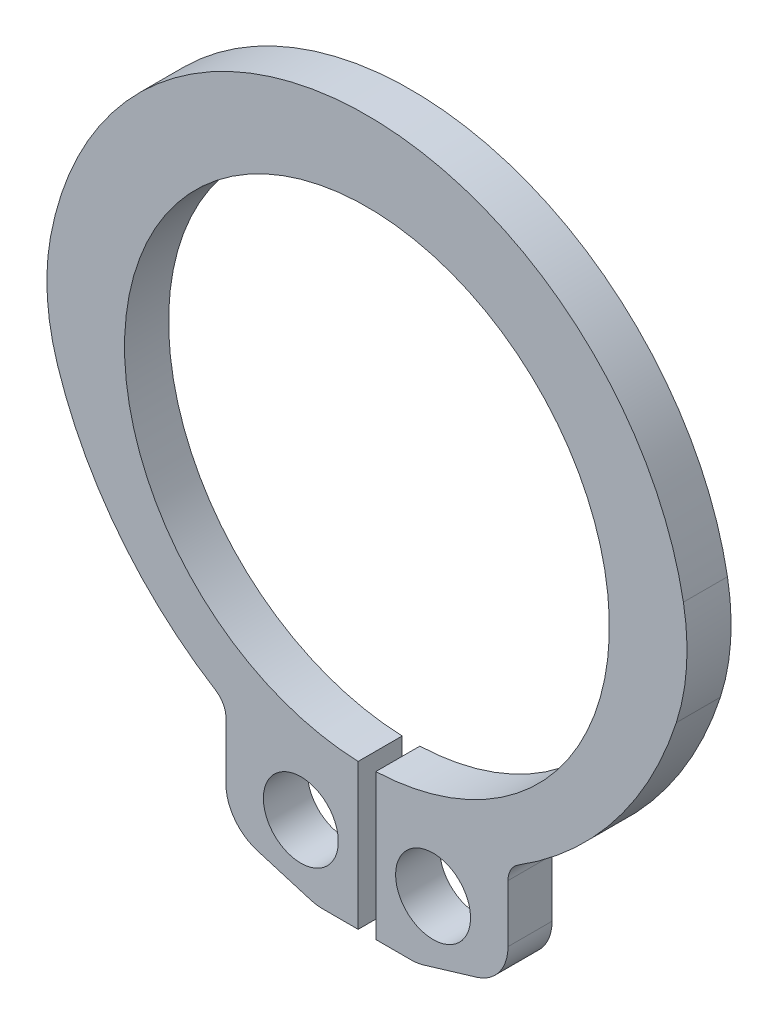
SolidWorks part; units mm, degrees
ref_plane "Front Plane" through (0, 0, 0) normal (0, 0, 1) x (1, 0, 0)
ref_plane "Top Plane" through (0, 0, 0) normal (0, 1, 0) x (1, 0, 0)
ref_plane "Right Plane" through (0, 0, 0) normal (1, 0, 0) x (0, 0, -1)
ref_plane "Plane1" through (0, 0, -0.5) normal (0, 0, -1) x (-1, 0, 0)
sketch "Sketch1" plane through (0, 0, -0.5) normal (0, 0, -1) x (-1, 0, 0)
  line L0 (-3.2, -6.1382) -> (-3.2, -7.4359)
  line L1 (-2.4875, -8.3937) -> (-1.2863, -8.7542)
  line L2 (-0.9988, -8.7964) -> (-0.2, -8.7964)
  line L3 (-0.2, -8.7964) -> (-0.2, -5.4964)
  line L4 (0.2, -5.4964) -> (0.2, -8.7964)
  line L5 (0.2, -8.7964) -> (0.9988, -8.7964)
  line L6 (1.2863, -8.7542) -> (2.4875, -8.3937)
  line L7 (3.2, -7.4359) -> (3.2, -6.1382)
  circle A0 centre (-1.5, -7.2964) radius 0.85
  circle A1 centre (1.5, -7.2964) radius 0.85
  arc A2 (-7.0182, -1.1259) -> (-3.4351, -5.7142) centre (1.0694, 1.4967) ccw
  arc A3 (-3.4351, -5.7142) -> (-3.2, -6.1382) centre (-3.7, -6.1382) cw
  arc A4 (-3.2, -7.4359) -> (-2.4875, -8.3937) centre (-2.2, -7.4359) ccw
  arc A5 (-1.2863, -8.7542) -> (-0.9988, -8.7964) centre (-0.9988, -7.7964) ccw
  arc A6 (-0.2, -5.4964) -> (0.2, -5.4964) centre (0, 0) cw
  arc A7 (0.9988, -8.7964) -> (1.2863, -8.7542) centre (0.9988, -7.7964) ccw
  arc A8 (2.4875, -8.3937) -> (3.2, -7.4359) centre (2.2, -7.4359) ccw
  arc A9 (3.2, -6.1382) -> (3.4351, -5.7142) centre (3.7, -6.1382) cw
  arc A10 (3.4351, -5.7142) -> (7.0182, -1.1259) centre (-1.0694, 1.4967) ccw
  arc A11 (7.0182, -1.1259) -> (7.1794, 1.3216) centre (2.262, 0.4164) ccw
  arc A12 (7.1794, 1.3216) -> (-7.1794, 1.3216) centre (0, 0) ccw
  arc A13 (-7.1794, 1.3216) -> (-7.0182, -1.1259) centre (-2.262, 0.4164) ccw
extrude "Boss-Extrude1" add sketch "Sketch1" against normal blind 1
